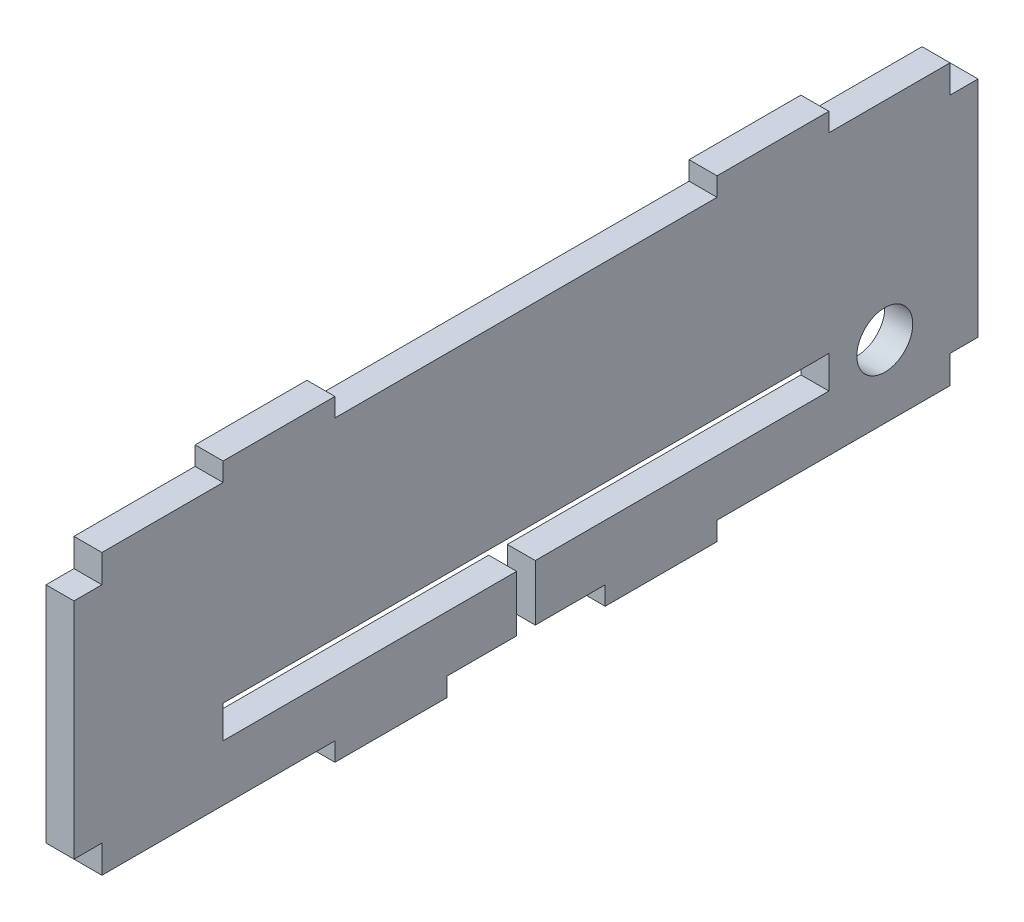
SolidWorks part; units mm, degrees
ref_plane "Front Plane" through (0, 0, 0) normal (0, 0, 1) x (1, 0, 0)
ref_plane "Top Plane" through (0, 0, 0) normal (0, 1, 0) x (1, 0, 0)
ref_plane "Right Plane" through (0, 0, 0) normal (1, 0, 0) x (0, 0, -1)
sketch "Sketch1" plane through (0, 0, 0) normal (1, 0, 0) x (0, 0, -1)
  line L0 (0, 0) -> (0, -32841.5669)
  line L1 (0, 0) -> (32841.5669, 0)
  line L2 (0, 5) -> (3, 5)
  line L3 (0, 0) -> (97, 0)
  line L4 (0, 0) -> (0, 34)
  line L5 (0, 34) -> (97, 34)
  line L6 (97, 0) -> (97, 34)
  line L11 (3, 5) -> (3, 2)
  line L12 (3, 2) -> (28, 2)
  line L13 (28, 2) -> (28, 0)
  line L14 (28, 0) -> (40, 0)
  line L15 (40, 0) -> (40, 2)
  line L16 (16, 8) -> (47.5, 8)
  line L17 (47.5, 8) -> (47.5, 2)
  line L18 (47.5, 2) -> (40, 2)
  line L19 (16, 8) -> (16, 11.5)
  line L20 (16, 11.5) -> (81, 11.5)
  line L21 (81, 11.5) -> (81, 8)
  line L22 (81, 8) -> (49.5, 8)
  line L23 (49.5, 8) -> (49.5, 2)
  line L24 (49.5, 2) -> (57, 2)
  line L25 (57, 2) -> (57, 0)
  line L26 (57, 0) -> (69, 0)
  line L27 (69, 0) -> (69, 2)
  line L28 (69, 2) -> (94, 2)
  line L29 (94, 2) -> (94, 5)
  line L30 (94, 5) -> (97, 5)
  line L31 (0, 29) -> (3, 29)
  line L32 (3, 29) -> (3, 32)
  line L33 (3, 32) -> (16, 32)
  line L34 (16, 32) -> (16, 34)
  line L35 (16, 34) -> (28, 34)
  line L36 (28, 34) -> (28, 32)
  line L37 (28, 32) -> (69, 32)
  line L38 (69, 32) -> (69, 34)
  line L39 (69, 34) -> (81, 34)
  line L40 (81, 34) -> (81, 32)
  line L41 (81, 32) -> (94, 32)
  line L42 (94, 32) -> (94, 29)
  line L43 (94, 29) -> (97, 29)
  circle A0 centre (87, 9.75) radius 3
  point P45 (0, 0)
  point P46 (81, 9.75)
  dimension "D12" = 7
  dimension "D1" = 34
  dimension "D2" = 97
  dimension "D3" = 2
  dimension "D4" = 3
  dimension "D5" = 3
  dimension "D6" = 2
  dimension "D7" = 12
  dimension "D8" = 17
  dimension "D9" = 3
  dimension "D10" = 3
  dimension "D11" = 12
  dimension "D13" = 12
  dimension "D14" = 2
  dimension "D15" = 2
  dimension "D16" = 12
  dimension "D17" = 2
  dimension "D18" = 3
  dimension "D19" = 5
  dimension "D20" = 3
  dimension "D21" = 12
  dimension "D22" = 12
  dimension "D23" = 3.5
  dimension "D24" = 6
extrude "Boss-Extrude1" add sketch "Sketch1" along normal blind 3 contours L43 L42 L41 L40 L5 L38 L37 L36 L34 L33 L32 L31 L4 L2 L11 L12 L13 L3 L15 L18 L17 L16 L19 L20 L21 L22 L23 L24 L25 L27 L28 L29 L30 L6
